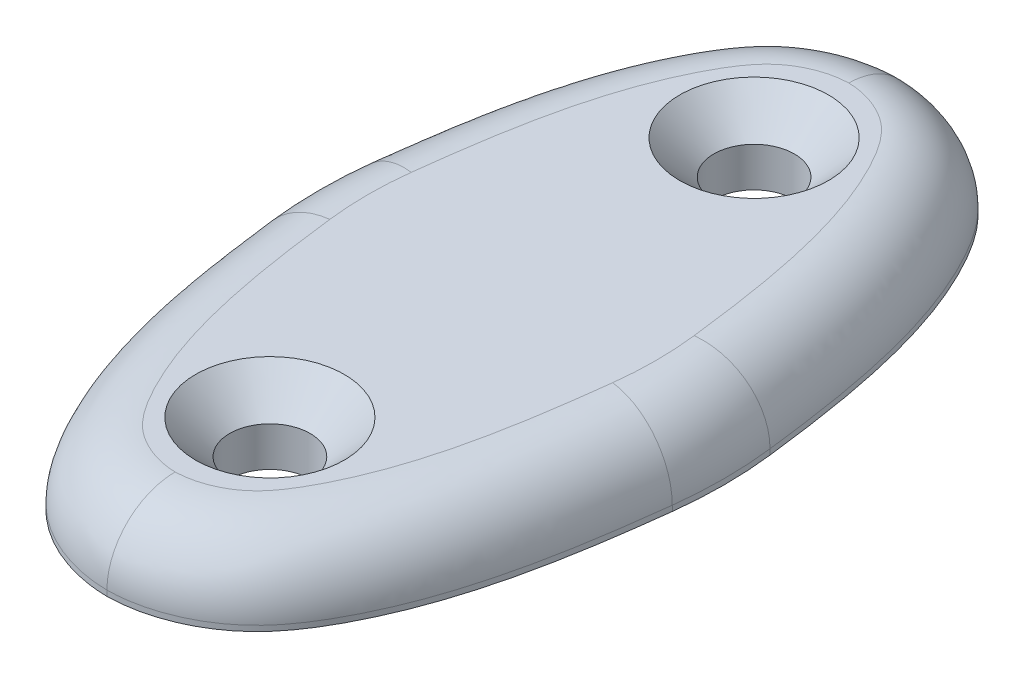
SolidWorks part; units mm, degrees
ref_plane "Front Plane" through (0, 0, 0) normal (0, 0, 1) x (1, 0, 0)
ref_plane "Top Plane" through (0, 0, 0) normal (0, 1, 0) x (1, 0, 0)
ref_plane "Right Plane" through (0, 0, 0) normal (1, 0, 0) x (0, 0, -1)
sketch "Sketch1" plane through (0, 0, 0) normal (0, 1, 0) x (1, 0, 0)
  line L0 (44.55, 237.6) -> (222.75, 237.6) construction
  line L1 (13.8434, 57.6686) -> (45.3434, 57.6686) construction
  line L2 (29.5934, 57.6686) -> (29.5934, 87.3686) construction
  spline S0 degree 3 poles (29.5934, 87.3686) (26.8917, 87.3392) (22.3703, 85.532) (18.0016, 78.732) (15.1669, 69.6092) (14.3294, 61.913) (13.8434, 57.6686) knots 0 0 0 0 0.222633 0.366287 0.649159 1 1 1 1
  spline S1 degree 3 poles (29.5934, 87.3686) (32.2951, 87.3392) (36.8164, 85.532) (41.1851, 78.732) (44.0198, 69.6092) (44.8573, 61.913) (45.3434, 57.6686) knots 0 0 0 0 0.222633 0.366287 0.649159 1 1 1 1
  spline S2 degree 3 poles (29.5934, 27.9686) (32.2951, 27.998) (36.8164, 29.8052) (41.1851, 36.6053) (44.0198, 45.7281) (44.8573, 53.4243) (45.3434, 57.6686) knots 0 0 0 0 0.222633 0.366287 0.649159 1 1 1 1
  spline S3 degree 3 poles (29.5934, 27.9686) (26.8917, 27.998) (22.3703, 29.8052) (18.0016, 36.6053) (15.1669, 45.7281) (14.3294, 53.4243) (13.8434, 57.6686) knots 0 0 0 0 0.222633 0.366287 0.649159 1 1 1 1
  point P7 (14.5614, 63.6417)
  point P28 (0, 0)
  dimension "D1" = 59.4
  dimension "D2" = 31.5
extrude "Boss-Extrude1" add sketch "Sketch1" along normal blind 5.4
fillet "Fillet1" radius 30 2 edges at (13.8434, 2.7, -57.6686) (45.3434, 2.7, -57.6686)
sketch "Sketch2" plane through (0, 5.4, 0) normal (0, 1, 0) x (1, 0, 0)
  line L0 (14.044, 57.6686) -> (45.1428, 57.6686) construction
  line L1 (29.5934, 39.9186) -> (29.5934, 75.4186)
  arc A0 (14.2589, 61.253) -> (14.2589, 54.0843) centre (44.044, 57.6686) ccw construction
  arc A1 (44.9279, 54.0843) -> (44.9279, 61.253) centre (15.1428, 57.6686) ccw construction
  circle A2 centre (29.5934, 75.4186) radius 2.95
  circle A3 centre (29.5934, 39.9186) radius 2.95
  point P8 (29.5934, 57.6686)
  point P12 (29.5934, 57.6686)
  dimension "D1" = 5.9
  dimension "D2" = 29.6
extrude "Cut-Extrude1" cut sketch "Sketch2" against normal through all both and the other way through all
fillet "Fillet2" radius 5 6 edges at (14.044, 5.4, -57.6686) (45.1428, 5.4, -57.6686)
chamfer "Chamfer1" distance 2.5 2 edges at (29.5934, 5.4, -72.4686) (29.5934, 5.4, -36.9686)
